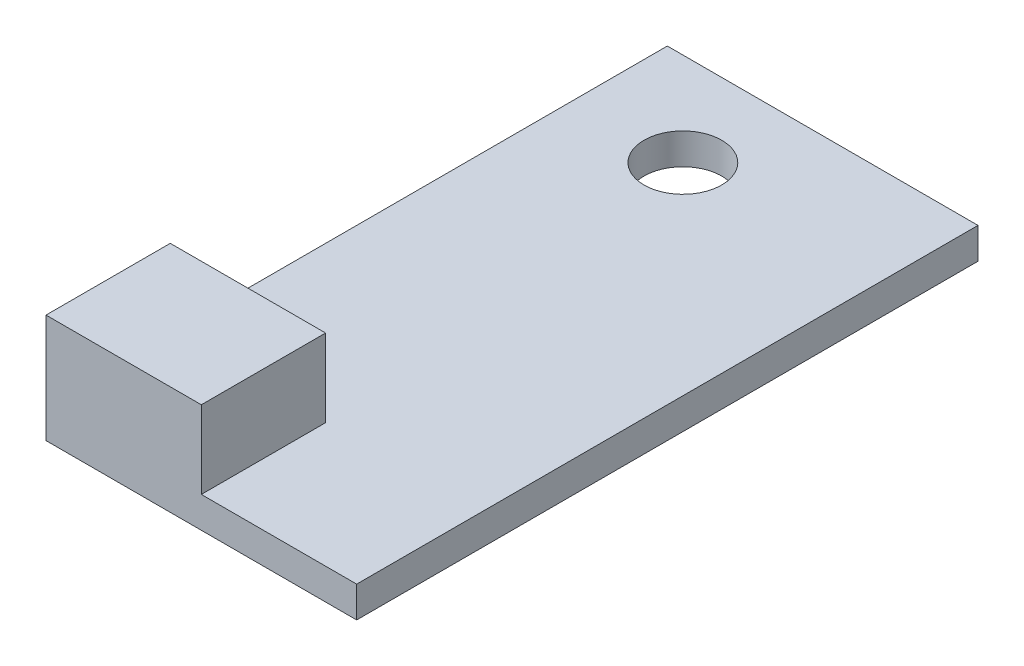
SolidWorks part; units mm, degrees
ref_plane "Front Plane" through (0, 0, 0) normal (0, 0, 1) x (1, 0, 0)
ref_plane "Top Plane" through (0, 0, 0) normal (0, 1, 0) x (1, 0, 0)
ref_plane "Right Plane" through (0, 0, 0) normal (1, 0, 0) x (0, 0, -1)
sketch "Sketch1" plane through (0, 0, 0) normal (0, 1, 0) x (1, 0, 0)
  line L1 (0, 0) -> (100, 0)
  line L2 (0, 0) -> (0, 200)
  line L3 (0, 200) -> (100, 200)
  line L4 (100, 0) -> (100, 200)
  dimension "D1" = 100
  dimension "D2" = 200
extrude "Boss-Extrude1" add sketch "Sketch1" along normal blind 10
sketch "Sketch2" plane through (0, 10, 0) normal (0, 1, 0) x (1, 0, 0)
  line L1 (0, 0) -> (50, 0)
  line L2 (0, 0) -> (0, 40)
  line L3 (0, 40) -> (50, 40)
  line L4 (50, 0) -> (50, 40)
  dimension "D1" = 50
  dimension "D2" = 40
extrude "Boss-Extrude2" add sketch "Sketch2" along normal blind 25
hole_wizard "Ø25.0 (25) Diameter Hole1" positions "Sketch4" profile "Sketch3" hole size "Ø25.0" standard "ANSI Metric"
sketch "Sketch4" plane through (0, 10, 0) normal (0, 1, 0) x (1, 0, 0)
  line L0 (0, 200) -> (0, 40) construction
  line L1 (100, 200) -> (0, 200) construction
  point P0 (35, 170)
  dimension "D1" = 35
  dimension "D2" = 30
sketch "Sketch3" plane through (35, 10, -170) normal (1, 0, 0) x (0, 0, 1)
  line L0 (0, 0) -> (0, 10)
  line L1 (0, 10) -> (12.5, 10)
  line L2 (12.5, 10) -> (12.5, 0)
  line L5 (12.5, 0) -> (0, 0)
  line L11 (0, -6.35) -> (0, 107.95) construction
  dimension "Thru Hole Dia." = 25
  dimension "Thru Hole Depth" = 10
